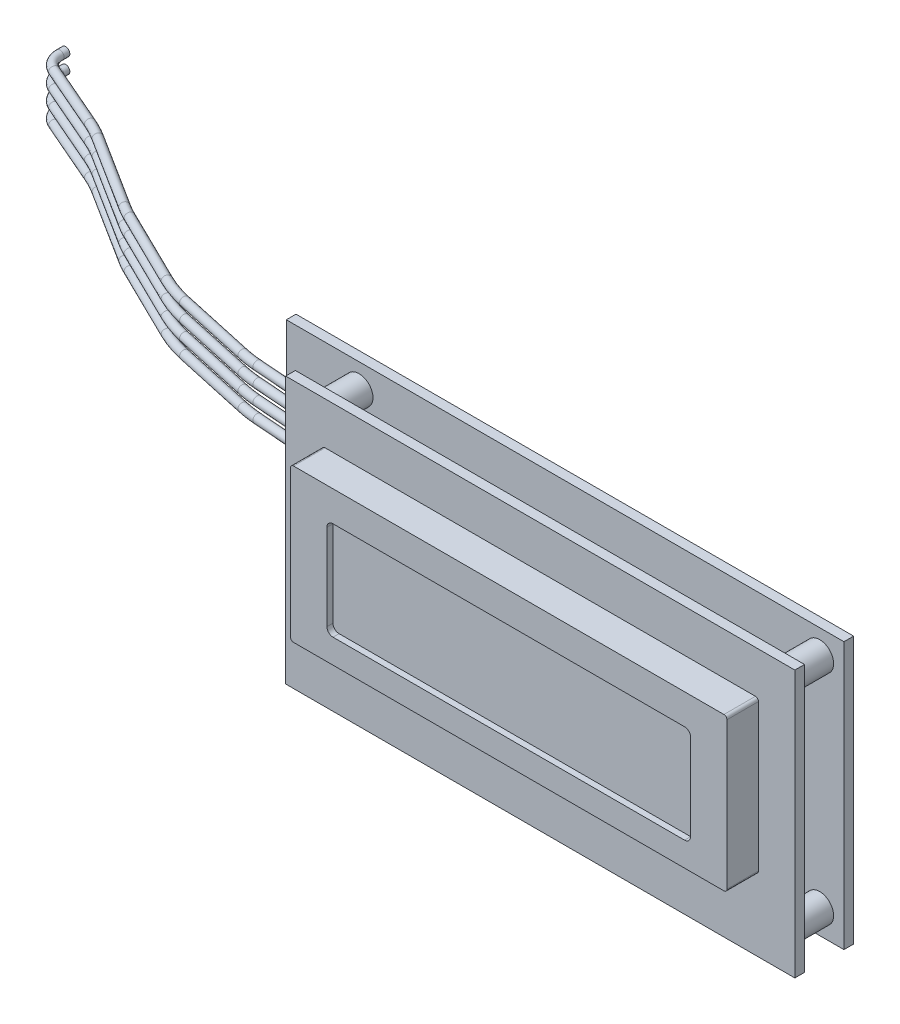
SolidWorks part; units mm, degrees
ref_plane "Plan de face" through (0, 0, 0) normal (0, 0, 1) x (1, 0, 0)
ref_plane "Plan de dessus" through (0, 0, 0) normal (0, 1, 0) x (1, 0, 0)
ref_plane "Plan de droite" through (0, 0, 0) normal (1, 0, 0) x (0, 0, -1)
sketch "Esquisse1" plane through (0, 0, 0) normal (0, 0, 1) x (1, 0, 0)
  line L1 (0, 0) -> (92, 0)
  line L2 (0, 0) -> (0, 44)
  line L3 (0, 44) -> (92, 44)
  line L4 (92, 0) -> (92, 44)
extrude "Extrusion1" add sketch "Esquisse1" along normal blind 1.6
sketch "Esquisse2" plane through (0, 0, 1.6) normal (0, 0, 1) x (1, 0, 0)
  line L0 (92, 62.8707) -> (92, -3.7953) construction
  line L1 (8, -3.7953) -> (8, 62.8707) construction
  line L2 (50, 32.038) -> (50, -5.1762) construction
  line L3 (41.3501, 22) -> (70.736, 22) construction
  line L4 (98.7972, 0) -> (-10.7979, 0) construction
  line L5 (12, 6.1446) -> (12, -5.1762) construction
  line L6 (5.822, 4) -> (23.2849, 4) construction
  circle A0 centre (12, 4) radius 2.3
  circle A1 centre (88, 4) radius 2.3
  circle A2 centre (88, 40) radius 2.3
  circle A3 centre (12, 40) radius 2.3
  dimension "D1" = 84
  dimension "D2" = 42
  dimension "D3" = 22
  dimension "D4" = 4
  dimension "D5" = 4
extrude "Extrusion2" add sketch "Esquisse2" along normal blind 6.5
sketch "Esquisse3" plane through (0, 0, 8.1) normal (0, 0, 1) x (1, 0, 0)
  line L0 (92, 51.513) -> (92, -8.6307) construction
  line L1 (100.5707, 0) -> (-15.9225, 0) construction
  line L2 (8, -8.6307) -> (8, 51.513) construction
  line L4 (96.4956, 44) -> (-9.318, 44) construction
  line L5 (8, 44) -> (92, 44)
  line L6 (8, 44) -> (8, 0)
  line L7 (8, 0) -> (92, 0)
  line L8 (92, 44) -> (92, 0)
  dimension "D1" = 84
extrude "Extrusion3" add sketch "Esquisse3" along normal blind 1.6
sketch "Esquisse4" plane through (0, 0, 9.7) normal (0, 0, 1) x (1, 0, 0)
  line L0 (92, 50.2483) -> (92, -9.7549) construction
  line L1 (-7.2101, 44) -> (97.7603, 44) construction
  line L2 (8, -9.7549) -> (8, 50.2483) construction
  line L3 (14, 50.2483) -> (14, 6.9673) construction
  line L4 (86, 50.2483) -> (86, 10.0588) construction
  line L5 (96.2145, 37) -> (4.7343, 37) construction
  line L6 (96.2145, 11.8) -> (4.7343, 11.8) construction
  line L8 (14.5, 37) -> (85.5, 37)
  line L9 (14, 36.5) -> (14, 12.3)
  line L10 (14.5, 11.8) -> (85.5, 11.8)
  line L11 (86, 36.5) -> (86, 12.3)
  arc A0 (14.5, 37) -> (14, 36.5) centre (14.5, 36.5) ccw
  arc A1 (85.5, 37) -> (86, 36.5) centre (85.5, 36.5) cw
  arc A2 (85.5, 11.8) -> (86, 12.3) centre (85.5, 12.3) ccw
  arc A3 (14, 12.3) -> (14.5, 11.8) centre (14.5, 12.3) ccw
  dimension "D5" = 0.5
  dimension "D1" = 6
  dimension "D2" = 6
  dimension "D3" = 7
  dimension "D4" = 25.2
extrude "Extrusion4" add sketch "Esquisse4" along normal blind 5.2
sketch "Esquisse5" plane through (0, 0, 14.9) normal (0, 0, 1) x (1, 0, 0)
  line L0 (96.7853, 44) -> (71.9802, 44) construction
  line L1 (92, 55.2205) -> (92, 31.4992) construction
  line L2 (96.7853, 32) -> (12.8648, 32) construction
  line L3 (80, 55.2205) -> (80, 10.0797) construction
  line L4 (100.582, 15.8) -> (12.4091, 15.8) construction
  line L5 (20, 55.2205) -> (20, 10.0797) construction
  line L7 (21, 32) -> (79, 32)
  line L8 (20, 31) -> (20, 16.8)
  line L9 (21, 15.8) -> (79, 15.8)
  line L10 (80, 31) -> (80, 16.8)
  arc A0 (21, 32) -> (20, 31) centre (21, 31) ccw
  arc A1 (20, 16.8) -> (21, 15.8) centre (21, 16.8) ccw
  arc A2 (79, 15.8) -> (80, 16.8) centre (79, 16.8) ccw
  arc A3 (79, 32) -> (80, 31) centre (79, 31) cw
  dimension "D5" = 1
  dimension "D1" = 12
  dimension "D2" = 12
  dimension "D3" = 16.2
  dimension "D4" = 60
extrude "Enlèv. mat.-Extru.1" cut sketch "Esquisse5" against normal blind 1
sketch "Esquisse7" plane through (0, 0, 0) normal (0, 0, -1) x (-1, 0, 0)
  line L0 (9.3623, 44) -> (1.3853, 44) construction
  line L1 (0, 45.1941) -> (0, 50.6566) construction
  line L2 (-4.3, 50.6566) -> (-4.3, 18.1415) construction
  line L3 (9.3623, 30.8) -> (-9.5398, 30.8) construction
  circle A0 centre (-4.3, 30.8) radius 0.7
  dimension "D1" = 13.2
  dimension "D2" = 4.3
ref_plane "Plan1" through (0, 30.8, 0) normal (0, 1, 0) x (-1, 0, 0)
sketch "Esquisse8" plane through (0, 30.8, 0) normal (0, 1, 0) x (-1, 0, 0)
  line L0 (0, -3.378) -> (0, 6.3005) construction
  line L1 (-4.3, -3.378) -> (-4.3, 5.8899) construction
  line L2 (-4.3, 0) -> (-4.3, -0.8079)
  line L3 (-3.3749, -1.8051) -> (9.1159, -2.7437)
  line L4 (11.9159, -3.1549) -> (24.2517, -5.8698)
  line L5 (28.7543, -7.443) -> (40.7988, -13.3456)
  line L6 (42.7043, -14.4122) -> (54.7422, -22.0419)
  line L7 (57.4892, -23.4969) -> (67.9279, -28.0255)
  line L8 (69.7339, -30.7776) -> (69.7339, -31.7249)
  arc A0 (54.7422, -22.0419) -> (57.4892, -23.4969) centre (65.4489, -5.1491) ccw
  arc A1 (40.7988, -13.3456) -> (42.7043, -14.4122) centre (31.9976, -31.305) cw
  arc A2 (24.2517, -5.8698) -> (28.7543, -7.443) centre (19.953, -25.4024) cw
  arc A3 (9.1159, -2.7437) -> (11.9159, -3.1549) centre (7.6172, -22.6875) cw
  arc A4 (67.9279, -28.0255) -> (69.7339, -30.7776) centre (66.7339, -30.7776) cw
  arc A5 (-4.3, -0.8079) -> (-3.3749, -1.8051) centre (-3.3, -0.8079) ccw
  dimension "D2" = 20
  dimension "D3" = 3
  dimension "D4" = 1
  dimension "D1" = 4.3
sweep "Balayage1" add profiles "Esquisse7" path "Esquisse8"
pattern_linear "Répétition linéaire1" count 4 spacing 2.54 along (0, -1, 0) of "Balayage1"
